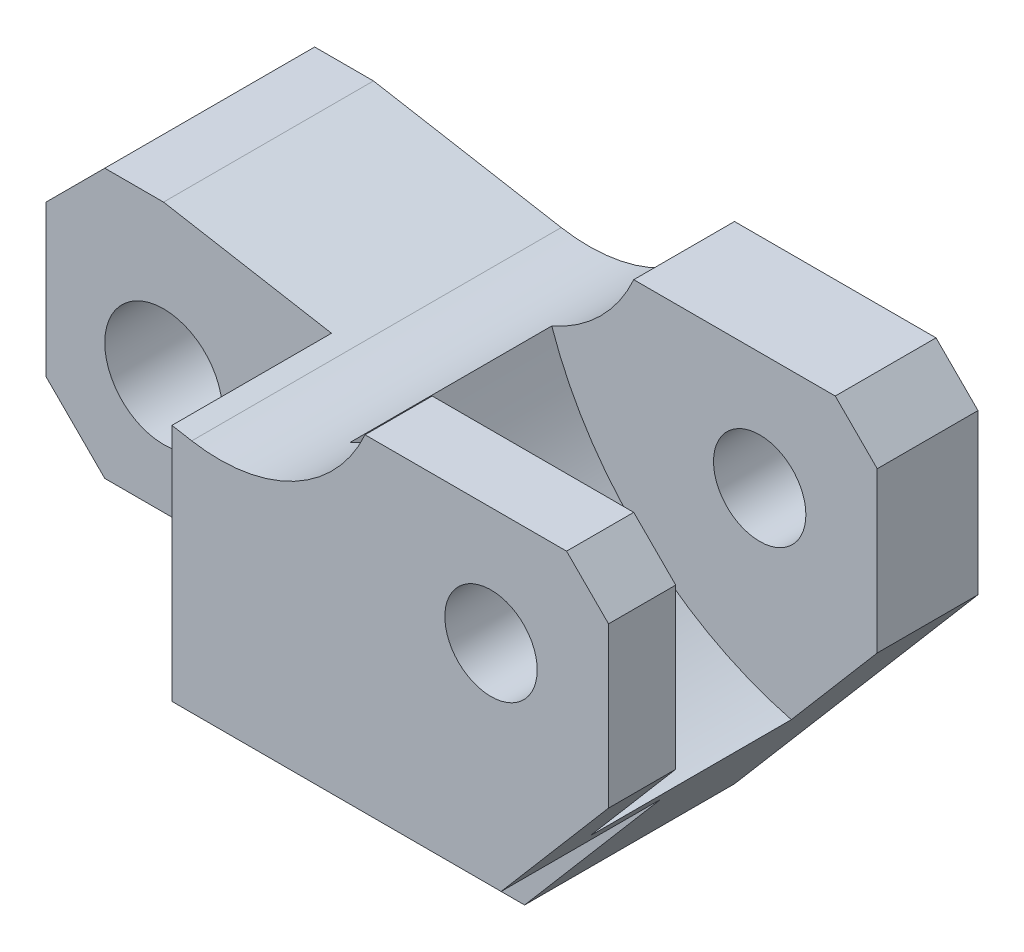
SolidWorks part; units mm, degrees
ref_plane "Front" through (0, 0, 0) normal (0, 0, 1) x (1, 0, 0)
ref_plane "Top" through (0, 0, 0) normal (0, 1, 0) x (1, 0, 0)
ref_plane "Right" through (0, 0, 0) normal (1, 0, 0) x (0, 0, -1)
sketch "Sketch1" plane through (0, 0, 0) normal (0, 0, 1) x (1, 0, 0)
  line L0 (0, 0) -> (0, 32)
  line L1 (0, 32) -> (14, 32)
  line L2 (14, 32) -> (36.3614, 28.0571)
  line L3 (57, 39) -> (86, 39)
  line L4 (86, 39) -> (86, 15)
  line L5 (86, 15) -> (57, -19)
  line L6 (57, -19) -> (51.297, -19)
  line L7 (0, 0) -> (39.5755, 0)
  arc A0 (36.3614, 28.0571) -> (57, 39) centre (39.6607, 46.7684) ccw
  arc A1 (39.5755, 0) -> (44.5212, -4.2647) centre (39.5755, -5) cw
  arc A2 (44.5212, -4.2647) -> (51.297, -19) centre (73.2059, 0) ccw
extrude "Boss-Extrude1" add sketch "Sketch1" along normal mid plane 44
chamfer "Chamfer1" distance 7 angle 45 2 edges at (0, 0, 0) (0, 32, 0)
chamfer "Chamfer2" distance 5 angle 45 1 edges at (86, 39, 0)
sketch "Sketch2" plane through (0, 0, 22) normal (0, 0, 1) x (1, 0, 0)
  line L0 (7, 0) -> (39.5755, 0) construction
  line L1 (0, 25) -> (0, 7) construction
  circle A0 centre (14, 14) radius 7
  dimension "D3" = 14
  dimension "D1" = 14
  dimension "D2" = 14
extrude "Cut-Extrude1" cut sketch "Sketch2" against normal through all
sketch "Sketch3" plane through (0, 39, 0) normal (0, 1, 0) x (1, 0, 0)
  line L0 (0, -22) -> (0, 22) construction
  line L1 (0, -3) -> (34, -3)
  line L2 (0, -3) -> (0, -22)
  line L3 (0, -22) -> (34, -22)
  line L4 (34, -3) -> (34, -22)
  line L5 (36.3614, -22) -> (14, -22) construction
  line L6 (86, 22) -> (86, -22) construction
  dimension "D1" = 19
  dimension "D2" = 52
extrude "Cut-Extrude2" cut sketch "Sketch3" against normal through all
sketch "Sketch4" plane through (0, 0, 22) normal (0, 0, 1) x (1, 0, 0)
  line L0 (39.5755, 0) -> (73.2059, 0)
  line L1 (57, -19) -> (86, 15) construction
  line L2 (51.297, -19) -> (57, -19) construction
  line L3 (51.297, -19) -> (57, -19)
  line L4 (57, -19) -> (73.2059, 0)
  arc A0 (44.5212, -4.2647) -> (39.5755, 0) centre (39.5755, -5) ccw construction
  arc A1 (44.5212, -4.2647) -> (51.297, -19) centre (73.2059, 0) ccw construction
  arc A2 (44.5212, -4.2647) -> (39.5755, 0) centre (39.5755, -5) ccw
  arc A3 (44.5212, -4.2647) -> (51.297, -19) centre (73.2059, 0) ccw
extrude "Cut-Extrude3" cut sketch "Sketch4" against normal blind 19
ref_plane "Plane1" through (0, 0, -10) normal (0, 0, -1) x (-1, 0, 0)
sketch "Sketch5" plane through (0, 0, -10) normal (0, 0, -1) x (-1, 0, 0)
  line L0 (-57, -19) -> (-86, 15) construction
  line L1 (-81, 39) -> (-57, 39) construction
  line L2 (-86, 15) -> (-86, 34) construction
  line L3 (-81, 39) -> (-86, 34) construction
  line L4 (-75.7647, 3) -> (-86, 15)
  line L5 (-86, 15) -> (-86, 34)
  line L6 (-81, 39) -> (-86, 34)
  line L7 (-81, 39) -> (-57, 39)
  arc A0 (-75.7647, 3) -> (-47.2369, 29.3443) centre (-86, 42.7019) ccw
  arc A1 (-57, 39) -> (-36.3614, 28.0571) centre (-39.6607, 46.7684) ccw construction
  arc A2 (-57, 39) -> (-47.2369, 29.3443) centre (-39.6607, 46.7684) ccw
  dimension "D2" = 41
  dimension "D1" = 36
extrude "Cut-Extrude4" cut sketch "Sketch5" against normal blind 24
sketch "Sketch6" plane through (0, 0, 22) normal (0, 0, 1) x (1, 0, 0)
  line L0 (81, 39) -> (57, 39) construction
  line L1 (86, 15) -> (86, 34) construction
  circle A0 centre (72, 25) radius 5.5
  dimension "D1" = 11
  dimension "D2" = 14
  dimension "D3" = 14
extrude "Cut-Extrude5" cut sketch "Sketch6" against normal through all
equation "\"A\"= 86"
equation "\"B\"= 58"
equation "\"C\"= 44"
equation "\"D3@Sketch1\"=\"A\""
equation "\"D8@Sketch1\"=\"B\""
equation "\"D1@Boss-Extrude1\"=\"C\""
